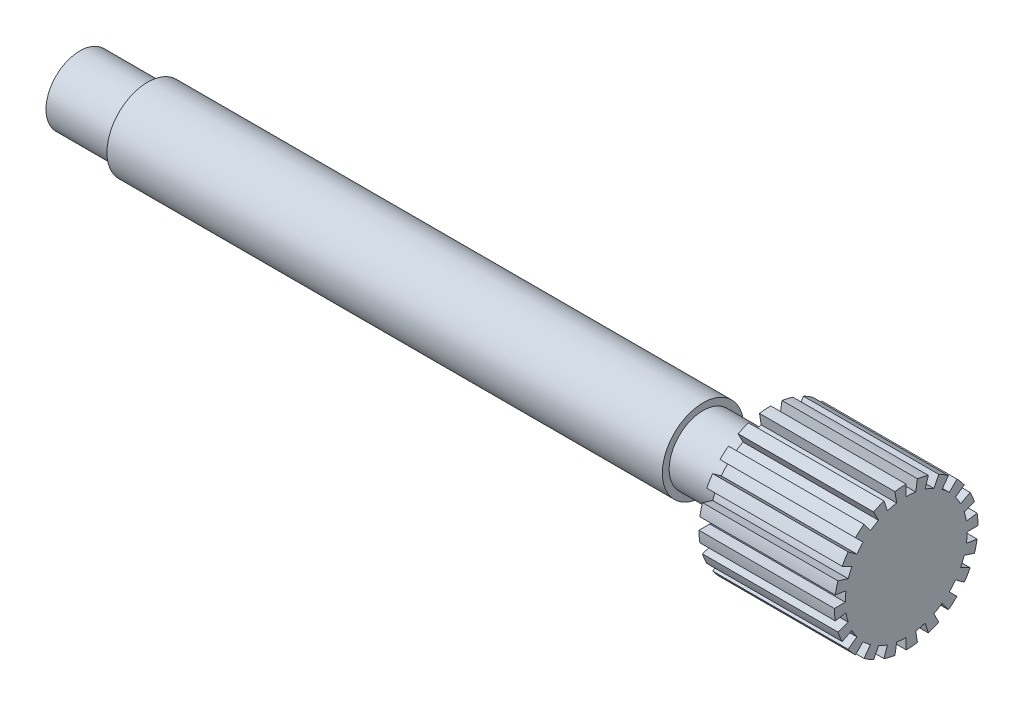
SolidWorks part; units mm, degrees
ref_plane "前视基准面" through (0, 0, 0) normal (0, 0, 1) x (1, 0, 0)
ref_plane "上视基准面" through (0, 0, 0) normal (0, 1, 0) x (1, 0, 0)
ref_plane "右视基准面" through (0, 0, 0) normal (1, 0, 0) x (0, 0, -1)
sketch "草图1" plane through (0, 0, 0) normal (0, 0, 1) x (1, 0, 0)
  line L0 (46, 2.5) -> (61, 2.5)
  line L1 (-31.6434, 0) -> (32.7441, 0) construction
  line L2 (0, 0) -> (0, 2.5)
  line L3 (0, 2.5) -> (5, 2.5)
  line L4 (61, 2.5) -> (61, 0)
  line L5 (61, 0) -> (0, 0)
  line L6 (5, 2.5) -> (5, 3)
  line L7 (5, 3) -> (46, 3)
  line L8 (46, 3) -> (46, 2.5)
  dimension "D1" = 5
  dimension "D2" = 41
  dimension "D3" = 5
  dimension "D4" = 15
  dimension "D5" = 6
revolve "旋转1" add sketch "草图1" angle 360 about L1
sketch "草图3" plane through (61, 0, 0) normal (1, 0, 0) x (0, 0, -1)
  line L0 (0, 0) -> (9.2576, 0) construction
  line L1 (0, 0) -> (8.4507, 2.7458) construction
  line L2 (4.4446, 0.704) -> (5.2347, 0.8291)
  line L3 (4.5, 0) -> (5.3, 0)
  line L4 (4.4446, -0.704) -> (5.2347, -0.8291)
  line L5 (4.2798, -1.3906) -> (5.0406, -1.6378)
  line L6 (4.0095, -2.043) -> (4.7223, -2.4061)
  line L7 (3.6406, -2.645) -> (4.2878, -3.1153)
  line L8 (3.182, -3.182) -> (3.7477, -3.7477)
  line L9 (2.645, -3.6406) -> (3.1153, -4.2878)
  line L10 (2.043, -4.0095) -> (2.4061, -4.7223)
  line L11 (1.3906, -4.2798) -> (1.6378, -5.0406)
  line L12 (0.704, -4.4446) -> (0.8291, -5.2347)
  line L13 (0, -4.5) -> (0, -5.3)
  line L14 (-0.704, -4.4446) -> (-0.8291, -5.2347)
  line L15 (-1.3906, -4.2798) -> (-1.6378, -5.0406)
  line L16 (-2.043, -4.0095) -> (-2.4061, -4.7223)
  line L17 (-2.645, -3.6406) -> (-3.1153, -4.2878)
  line L18 (-3.182, -3.182) -> (-3.7477, -3.7477)
  line L19 (-3.6406, -2.645) -> (-4.2878, -3.1153)
  line L20 (-4.0095, -2.043) -> (-4.7223, -2.4061)
  line L21 (-4.2798, -1.3906) -> (-5.0406, -1.6378)
  line L22 (-4.4446, -0.704) -> (-5.2347, -0.8291)
  line L23 (-4.5, 0) -> (-5.3, 0)
  line L24 (-4.4446, 0.704) -> (-5.2347, 0.8291)
  line L25 (-4.2798, 1.3906) -> (-5.0406, 1.6378)
  line L26 (-4.0095, 2.043) -> (-4.7223, 2.4061)
  line L27 (-3.6406, 2.645) -> (-4.2878, 3.1153)
  line L28 (-3.182, 3.182) -> (-3.7477, 3.7477)
  line L29 (-2.645, 3.6406) -> (-3.1153, 4.2878)
  line L30 (-2.043, 4.0095) -> (-2.4061, 4.7223)
  line L31 (-1.3906, 4.2798) -> (-1.6378, 5.0406)
  line L32 (-0.704, 4.4446) -> (-0.8291, 5.2347)
  line L33 (0, 4.5) -> (0, 5.3)
  line L34 (0.704, 4.4446) -> (0.8291, 5.2347)
  line L35 (1.3906, 4.2798) -> (1.6378, 5.0406)
  line L36 (2.043, 4.0095) -> (2.4061, 4.7223)
  line L37 (2.645, 3.6406) -> (3.1153, 4.2878)
  line L38 (3.182, 3.182) -> (3.7477, 3.7477)
  line L39 (3.6406, 2.645) -> (4.2878, 3.1153)
  line L40 (4.0095, 2.043) -> (4.7223, 2.4061)
  line L41 (4.2798, 1.3906) -> (5.0406, 1.6378)
  arc A0 (4.4446, 0.704) -> (4.2798, 1.3906) centre (0, 0) ccw
  arc A1 (5.3, 0) -> (5.2347, 0.8291) centre (0, 0) ccw
  arc A2 (4.4446, -0.704) -> (4.5, 0) centre (0, 0) ccw
  arc A3 (5.0406, -1.6378) -> (5.2347, -0.8291) centre (0, 0) ccw
  arc A4 (4.0095, -2.043) -> (4.2798, -1.3906) centre (0, 0) ccw
  arc A5 (4.2878, -3.1153) -> (4.7223, -2.4061) centre (0, 0) ccw
  arc A6 (3.182, -3.182) -> (3.6406, -2.645) centre (0, 0) ccw
  arc A7 (3.1153, -4.2878) -> (3.7477, -3.7477) centre (0, 0) ccw
  arc A8 (2.043, -4.0095) -> (2.645, -3.6406) centre (0, 0) ccw
  arc A9 (1.6378, -5.0406) -> (2.4061, -4.7223) centre (0, 0) ccw
  arc A10 (0.704, -4.4446) -> (1.3906, -4.2798) centre (0, 0) ccw
  arc A11 (0, -5.3) -> (0.8291, -5.2347) centre (0, 0) ccw
  arc A12 (-0.704, -4.4446) -> (0, -4.5) centre (0, 0) ccw
  arc A13 (-1.6378, -5.0406) -> (-0.8291, -5.2347) centre (0, 0) ccw
  arc A14 (-2.043, -4.0095) -> (-1.3906, -4.2798) centre (0, 0) ccw
  arc A15 (-3.1153, -4.2878) -> (-2.4061, -4.7223) centre (0, 0) ccw
  arc A16 (-3.182, -3.182) -> (-2.645, -3.6406) centre (0, 0) ccw
  arc A17 (-4.2878, -3.1153) -> (-3.7477, -3.7477) centre (0, 0) ccw
  arc A18 (-4.0095, -2.043) -> (-3.6406, -2.645) centre (0, 0) ccw
  arc A19 (-5.0406, -1.6378) -> (-4.7223, -2.4061) centre (0, 0) ccw
  arc A20 (-4.4446, -0.704) -> (-4.2798, -1.3906) centre (0, 0) ccw
  arc A21 (-5.3, 0) -> (-5.2347, -0.8291) centre (0, 0) ccw
  arc A22 (-4.4446, 0.704) -> (-4.5, 0) centre (0, 0) ccw
  arc A23 (-5.0406, 1.6378) -> (-5.2347, 0.8291) centre (0, 0) ccw
  arc A24 (-4.0095, 2.043) -> (-4.2798, 1.3906) centre (0, 0) ccw
  arc A25 (-4.2878, 3.1153) -> (-4.7223, 2.4061) centre (0, 0) ccw
  arc A26 (-3.182, 3.182) -> (-3.6406, 2.645) centre (0, 0) ccw
  arc A27 (-3.1153, 4.2878) -> (-3.7477, 3.7477) centre (0, 0) ccw
  arc A28 (-2.043, 4.0095) -> (-2.645, 3.6406) centre (0, 0) ccw
  arc A29 (-1.6378, 5.0406) -> (-2.4061, 4.7223) centre (0, 0) ccw
  arc A30 (-0.704, 4.4446) -> (-1.3906, 4.2798) centre (0, 0) ccw
  arc A31 (0, 5.3) -> (-0.8291, 5.2347) centre (0, 0) ccw
  arc A32 (0.704, 4.4446) -> (0, 4.5) centre (0, 0) ccw
  arc A33 (1.6378, 5.0406) -> (0.8291, 5.2347) centre (0, 0) ccw
  arc A34 (2.043, 4.0095) -> (1.3906, 4.2798) centre (0, 0) ccw
  arc A35 (3.1153, 4.2878) -> (2.4061, 4.7223) centre (0, 0) ccw
  arc A36 (3.182, 3.182) -> (2.645, 3.6406) centre (0, 0) ccw
  arc A37 (4.2878, 3.1153) -> (3.7477, 3.7477) centre (0, 0) ccw
  arc A38 (4.0095, 2.043) -> (3.6406, 2.645) centre (0, 0) ccw
  arc A39 (5.0406, 1.6378) -> (4.7223, 2.4061) centre (0, 0) ccw
  point P107 (0, 0)
  dimension "D2" = 4.5
  dimension "D3" = 0.8
  dimension "D1" = 18
  dimension "D4" = 20
extrude "凸台-拉伸1" add sketch "草图3" against normal blind 10
